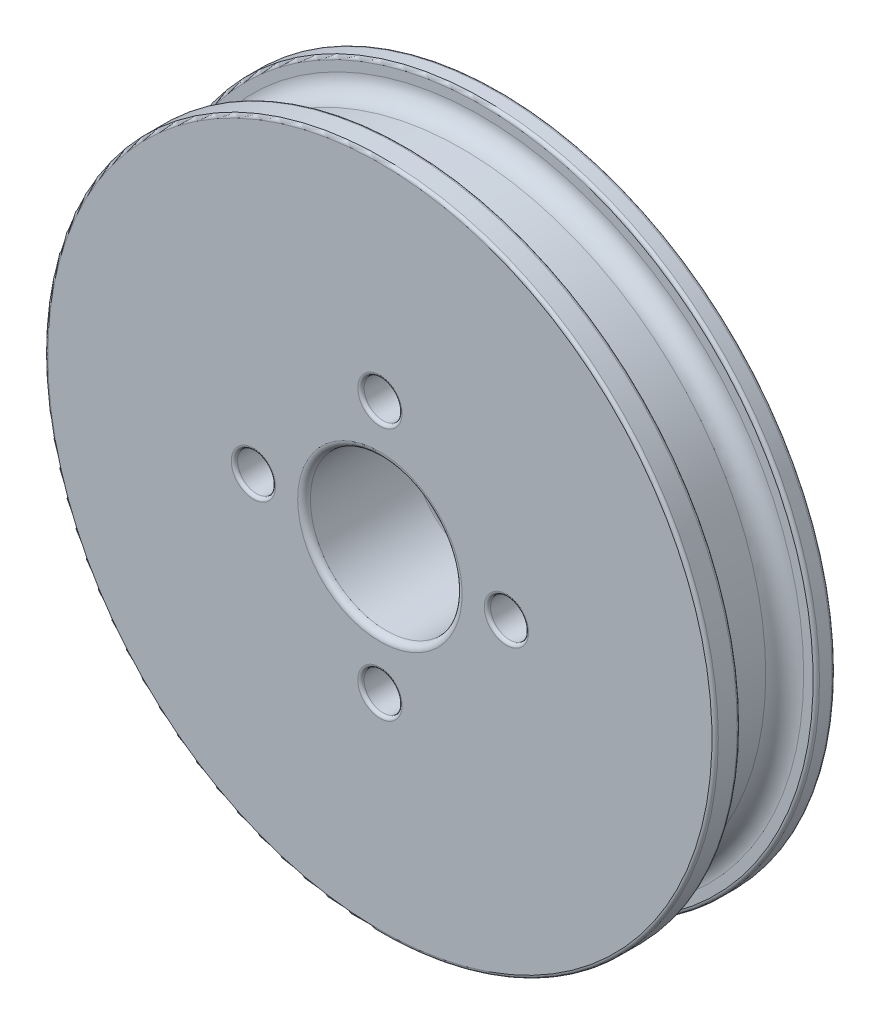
SolidWorks part; units mm, degrees
ref_plane "Спереди" through (0, 0, 0) normal (0, 0, 1) x (1, 0, 0)
ref_plane "Сверху" through (0, 0, 0) normal (0, 1, 0) x (1, 0, 0)
ref_plane "Справа" through (0, 0, 0) normal (1, 0, 0) x (0, 0, -1)
sketch "Эскиз1" plane through (0, 0, 0) normal (1, 0, 0) x (0, 0, -1)
  line L0 (-4.5, 0) -> (4.5, 0) construction
  line L1 (-4.5, 6) -> (4.5, 6)
  line L2 (-4.5, 6) -> (-4.5, 26.5)
  line L3 (-4.5, 26.5) -> (-2.5, 26.5)
  line L4 (4.5, 6) -> (4.5, 16)
  line L5 (4.5, 16) -> (5, 16)
  line L6 (5, 16) -> (5, 26.5)
  line L7 (5, 26.5) -> (3.5, 26.5)
  line L8 (-4.5, 24) -> (5, 24) construction
  line L9 (-2.5, 26.5) -> (-2.5, 25.5)
  line L10 (3.5, 26.5) -> (3.5, 25.5)
  line L11 (-1, 24) -> (2, 24)
  arc A0 (-2.5, 25.5) -> (-1, 24) centre (-1, 25.5) ccw
  arc A1 (2, 24) -> (3.5, 25.5) centre (2, 25.5) ccw
  dimension "D6" = 3
  dimension "D1" = 12
  dimension "D2" = 9
  dimension "D3" = 0.5
  dimension "D4" = 53
  dimension "D5" = 24
  dimension "D7" = 1.5
  dimension "D8" = 32
  dimension "D9" = 6
revolve "Повернуть1" add sketch "Эскиз1" angle 360 about L0
sketch "Эскиз2" plane through (0, 0, 0) normal (0, 0, 1) x (1, 0, 0)
  line L0 (0, 10) -> (0, 0) construction
  line L1 (0, 0) -> (10, 0) construction
  circle A0 centre (0, 10) radius 1.5
  circle A1 centre (0, 0) radius 10 construction
  circle A2 centre (10, 0) radius 1.5
  circle A3 centre (0, -10) radius 1.5
  circle A4 centre (-10, 0) radius 1.5
  dimension "D1" = 3
  dimension "D2" = 20
  dimension "D3" = 4
extrude "Вырез-Вытянуть1" cut sketch "Эскиз2" against normal mid plane 10
fillet "Скругление1" radius 0.5 2 edges at (6, 0, 4.5) (6, 0, -4.5)
fillet "Скругление2" radius 0.25 13 edges at (-1.5, -10, 4.5) (1.5, -10, -4.5) (26.5, 0, 2.5) (26.5, 0, 4.5) (26.5, 0, -3.5) (16, 0, -5) (26.5, 0, -5) (-11.5, 0, 4.5) (-8.5, 0, -4.5) (-1.5, 10, 4.5) (1.5, 10, -4.5) (8.5, 0, 4.5) (11.5, 0, -4.5)
